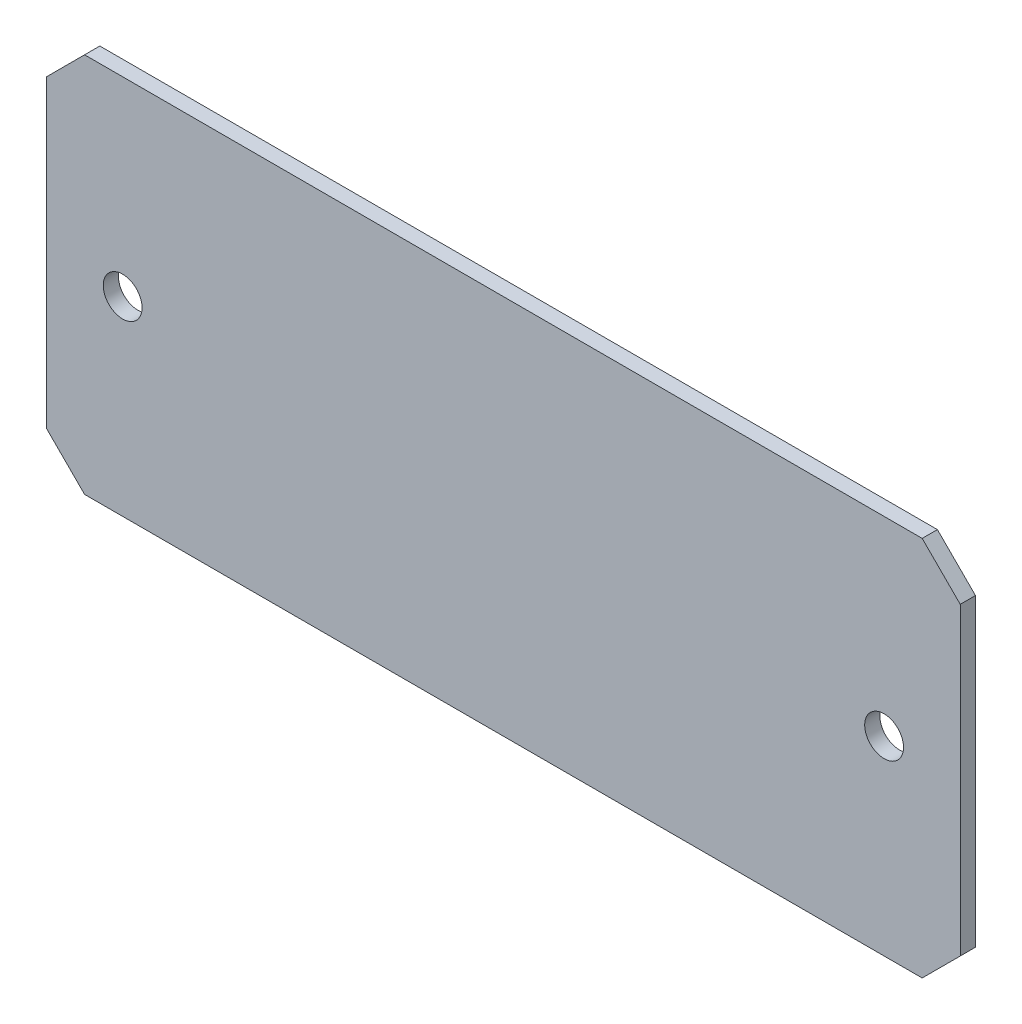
SolidWorks part; units mm, degrees
ref_plane "Plan de face" through (0, 0, 0) normal (0, 0, 1) x (1, 0, 0)
ref_plane "Plan de dessus" through (0, 0, 0) normal (0, 1, 0) x (1, 0, 0)
ref_plane "Plan de droite" through (0, 0, 0) normal (1, 0, 0) x (0, 0, -1)
sketch "Esquisse1" plane through (0, 0, 0) normal (0, 0, 1) x (1, 0, 0)
  line L1 (0, 0) -> (240, 0)
  line L2 (0, 0) -> (0, 100)
  line L3 (0, 100) -> (240, 100)
  line L4 (240, 0) -> (240, 100)
  dimension "D1" = 100
  dimension "D2" = 240
extrude "Extrusion1" add sketch "Esquisse1" along normal blind 4
chamfer "Chanfrein1" distance 10 angle 45 4 edges at (240, 0, 2) (240, 100, 2) (0, 0, 2) (0, 100, 2)
hole_wizard "Trou taraudé M122" positions "Esquisse3D4" profile "Esquisse5" tap size "M12" standard "ISO"
sketch3d "Esquisse3D4"
  line L0 (120, 100, 4) -> (120, 0, 4) construction
  line L1 (230, 100, 4) -> (10, 100, 4) construction
  line L2 (10, 0, 4) -> (230, 0, 4) construction
  line L4 (0, 50, 4) -> (240, 50, 4) construction
  line L5 (0, 90, 4) -> (0, 10, 4) construction
  line L6 (240, 10, 4) -> (240, 90, 4) construction
  point P0 (20, 50, 4)
  point P2 (220, 50, 4)
  dimension "D1" = 200
  dimension "D2" = 100
sketch "Esquisse5" plane through (20, 50, 4) normal (1, 0, 0) x (0, -1, 0)
  line L0 (0, 0) -> (0, 32.3144)
  line L1 (0, 32.3144) -> (5.1, 29.25)
  line L2 (5.1, 29.25) -> (5.1, 0)
  line L5 (5.1, 0) -> (0, 0)
  line L10 (0, 32.3144) -> (-5.1, 29.25) construction
  line L11 (0, -6.35) -> (0, 107.95) construction
  dimension "Diamètre du trou pour taraudage" = 10.2
  dimension "Profondeur du trou pour taraudage" = 29.25
  dimension "Angle de pointe" = 118
